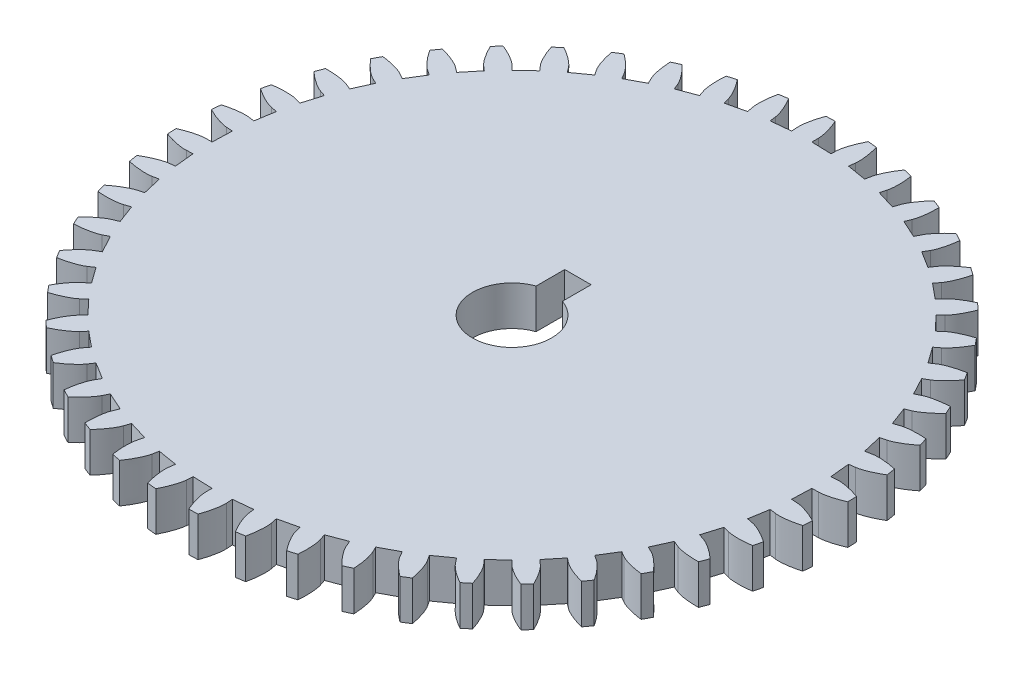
SolidWorks part; units mm, degrees
ref_plane "Front Plane" through (0, 0, 0) normal (0, 0, 1) x (1, 0, 0)
ref_plane "Top Plane" through (0, 0, 0) normal (0, 1, 0) x (1, 0, 0)
ref_plane "Right Plane" through (0, 0, 0) normal (1, 0, 0) x (0, 0, -1)
sketch "Sketch1" plane through (0, 0, 0) normal (0, 1, 0) x (1, 0, 0)
  line L0 (0, 0) -> (0, 11.6178) construction
  line L1 (0, 0) -> (-11.6178, 0) construction
  line L2 (0, 0) -> (-12.4933, -0.409) construction
  line L3 (0, 0) -> (-11.5929, -0.7598) construction
  line L4 (0, 0) -> (-11.5184, -1.5164) construction
  circle A0 centre (0, 0) radius 12 construction
  circle A1 centre (0, 0) radius 11.6178 construction
  circle A2 centre (0, 0) radius 11.375 construction
  circle A3 centre (0, 0) radius 12.5 construction
  spline S0 degree 4 poles (-11.6178, 0) (-11.6346, 0) (-11.6816, -0.0017) (-11.7702, -0.0118) (-11.9134, -0.0378) (-12.0931, -0.085) (-12.321, -0.1616) (-12.5829, -0.2718) (-12.8622, -0.4131) (-13.1555, -0.588) (-13.4378, -0.7806) (-13.7088, -0.9888) (-13.9686, -1.2108) (-14.2704, -1.4951) (-14.6138, -1.8588) (-14.9858, -2.3114) (-15.3716, -2.8607) (-15.7231, -3.4472) (-16.0342, -4.0558) (-16.3059, -4.6833) (-16.51, -5.2451) (-16.6614, -5.7353) (-16.7945, -6.2292) (-16.8903, -6.6473) (-16.9712, -7.0632) (-17.0378, -7.4902) (-17.082, -7.82) (-17.1186, -8.1759) (-17.1454, -8.4873) (-17.1701, -8.9474) (-17.1773, -9.2236) (-17.1811, -9.6653) (-17.1727, -9.8781) (-17.1693, -10.0615) (-17.1657, -10.1111) (-17.1643, -10.1517) knots 0 0 0 0 0 0.005377 0.015084 0.028532 0.04661 0.064855 0.092111 0.119476 0.146842 0.174209 0.201575 0.228941 0.256307 0.307035 0.361767 0.4165 0.471232 0.525964 0.580697 0.635429 0.662795 0.690161 0.744894 0.77226 0.799626 0.826992 0.854358 0.881725 0.909091 0.954545 0.977273 0.988636 1 1 1 1 1 construction
  spline S1 degree 4 poles (-11.6178, 0) (-11.6346, 0) (-11.6816, -0.0017) (-11.7702, -0.0118) (-11.9134, -0.0378) (-12.0931, -0.085) (-12.321, -0.1616) (-12.5829, -0.2718) (-12.8622, -0.4131) (-13.1555, -0.588) (-13.4378, -0.7806) (-13.7088, -0.9888) (-13.9686, -1.2108) (-14.2704, -1.4951) (-14.6138, -1.8588) (-14.9858, -2.3114) (-15.3716, -2.8607) (-15.7231, -3.4472) (-16.0342, -4.0558) (-16.3059, -4.6833) (-16.51, -5.2451) (-16.6614, -5.7353) (-16.7945, -6.2292) (-16.8903, -6.6473) (-16.9712, -7.0632) (-17.0378, -7.4902) (-17.082, -7.82) (-17.1186, -8.1759) (-17.1454, -8.4873) (-17.1613, -8.7835) (-17.1679, -8.9402) (-17.1705, -9.0178) knots 0 0 0 0 0 0.005377 0.015084 0.028532 0.04661 0.064855 0.092111 0.119476 0.146842 0.174209 0.201575 0.228941 0.256307 0.307035 0.361767 0.4165 0.471232 0.525964 0.580697 0.635429 0.662795 0.690161 0.744894 0.77226 0.799626 0.826992 0.854358 0.881725 0.909091 0.909091 0.909091 0.909091 0.909091
  dimension "D1" = 25
  dimension "D2" = 24
  dimension "D3" = 23.2355
  dimension "D4" = 22.75
  dimension "D5" = 11.6178
  dimension "D6" = 1.875
  dimension "D7" = 3.75
  dimension "D8" = 7.5
sketch "Sketch2" plane through (0, 0, 0) normal (0, 1, 0) x (1, 0, 0)
  line L0 (0, 0) -> (-12.4933, -0.409) construction
  line L1 (0, 0) -> (-12.4933, -0.409) construction
  line L2 (0, 0) -> (-11.5929, -0.7598) construction
  line L3 (0, 0) -> (-11.6178, 0) construction
  line L4 (0, 0) -> (-11.5184, -1.5164) construction
  line L5 (0, 0) -> (-11.5929, -0.7598) construction
  line L6 (0, 0) -> (-11.6178, 0) construction
  line L7 (0, 0) -> (-11.5184, -1.5164) construction
  line L8 (-11.5929, -0.7598) -> (-11.3506, -0.744)
  line L9 (-11.3506, -0.744) -> (-11.2777, -1.4847)
  line L10 (-11.2777, -1.4847) -> (-11.5184, -1.5164) construction
  line L11 (-11.2777, -1.4847) -> (-1.4872, -0.1958)
  line L12 (-11.6178, 0) -> (-1.5, 0)
  circle A0 centre (0, 0) radius 11.375 construction
  circle A1 centre (0, 0) radius 11.6178 construction
  circle A2 centre (0, 0) radius 12 construction
  circle A3 centre (0, 0) radius 12.5 construction
  circle A4 centre (0, 0) radius 11.375 construction
  circle A5 centre (0, 0) radius 11.6178 construction
  circle A6 centre (0, 0) radius 12 construction
  circle A7 centre (0, 0) radius 12.5 construction
  arc A8 (-12.4866, -0.5796) -> (-12.4977, -0.2383) centre (0, 0) cw
  circle A11 centre (0, 0) radius 1.5 construction
  arc A12 (-1.5, 0) -> (-1.4872, -0.1958) centre (0, 0) ccw
  spline S0 degree 4 poles (-40.5218, -999.5755) (-8.989, -23.0744) (-9.5874, -0.5071) (-10.7927, 0.166) (-11.9134, -0.0378) (-12.0931, -0.085) (-12.321, -0.1616) (-12.5829, -0.2718) (-12.8622, -0.4131) (-13.1555, -0.588) (-13.4378, -0.7806) (-13.7088, -0.9888) (-13.9686, -1.2108) (-14.2704, -1.4951) (-14.6138, -1.8588) (-14.9858, -2.3114) (-15.3716, -2.8607) (-15.7231, -3.4472) (-16.0342, -4.0558) (-16.3059, -4.6833) (-16.51, -5.2451) (-16.6614, -5.7353) (-16.7945, -6.2292) (-16.8903, -6.6473) (-16.9712, -7.0632) (-17.0378, -7.4902) (-17.082, -7.82) (-17.1186, -8.1759) (-17.2447, -9.644) (-17.2182, -13.2502) (-15.7248, 22.3468) (-49.5832, -1008.4145) knots -0.318217 -0.318217 -0.318217 -0.318217 -0.318217 0.005377 0.015084 0.028532 0.04661 0.064855 0.092111 0.119476 0.146842 0.174209 0.201575 0.228941 0.256307 0.307035 0.361767 0.4165 0.471232 0.525964 0.580697 0.635429 0.662795 0.690161 0.744894 0.77226 0.799626 0.826992 0.854358 0.881725 1.315655 1.315655 1.315655 1.315655 1.315655 only from (-11.6178, 0) to (-17.1705, -9.0178) construction
  spline S1 degree 4 poles (-11.6178, 0) (-11.6346, 0) (-11.6816, -0.0017) (-11.7702, -0.0118) (-11.9134, -0.0378) (-12.0931, -0.085) (-12.2658, -0.1431) (-12.3962, -0.1946) (-12.4732, -0.2276) (-12.4977, -0.2383) knots 0 0 0 0 0 0.005377 0.015084 0.028532 0.04661 0.064855 0.073447 0.073447 0.073447 0.073447 0.073447
  spline S2 degree 4 poles (-11.5929, -0.7598) (-11.6096, -0.7609) (-11.6567, -0.7623) (-11.7458, -0.758) (-11.8903, -0.7414) (-12.0728, -0.7061) (-12.2489, -0.6595) (-12.3824, -0.6166) (-12.4614, -0.5887) (-12.4866, -0.5796) knots 0 0 0 0 0 0.005377 0.015084 0.028532 0.04661 0.064855 0.073447 0.073447 0.073447 0.073447 0.073447
  point P21 (-11.3506, -0.744)
  point P24 (-11.2777, -1.4847)
  dimension "D2" = 3
extrude "Boss-Extrude1" add sketch "Sketch2" along normal blind 1.5
pattern_circular "CirPattern1" count 48 over 360 of "Boss-Extrude1"
sketch "Sketch3" plane through (0, 1.5, 0) normal (0, 1, 0) x (1, 0, 0)
  line L1 (0.5, 0.5) -> (-0.5, 0.5)
  line L2 (0.5, 0.5) -> (0.5, 2.5)
  line L3 (0.5, 2.5) -> (-0.5, 2.5)
  line L4 (-0.5, 0.5) -> (-0.5, 2.5)
  line L5 (0.5, 0.5) -> (-0.5, 2.5) construction
  line L6 (0.5, 2.5) -> (-0.5, 0.5) construction
  circle A0 centre (0, 0) radius 1.5 construction
  point P0 (0, 1.5)
  dimension "D1" = 2
  dimension "D2" = 1
extrude "Cut-Extrude1" cut sketch "Sketch3" against normal up to surface (1.5 mm away)
equation "\"Module\"= .5"
equation "\"Number of Teeth\" = 48"
equation "\"Pressure Angle\"= 14.5deg"
equation "\"Pitch Diameter\"= \"Number of Teeth\" * \"Module\""
equation "\"Circular Pitch\"= pi * \"Module\""
equation "\"Addendum\"= \"Module\""
equation "\"Dedendum\"= 1.25 * \"Module\""
equation "\"Base Diameter\"= \"Pitch Diameter\" * cos ( \"Pressure Angle\" )"
equation "\"Base Radius\"= \"Base Diameter\" / 2"
equation "\"Width\"= 1.5"
equation "\"Outside Diameter\"= \"Pitch Diameter\" + 2 * \"Addendum\""
equation "\"D1@Sketch1\"=\"Outside Diameter\""
equation "\"D3@Sketch1\"=\"Base Diameter\""
equation "\"Root Diameter\"= \"Pitch Diameter\" - 2 * \"Dedendum\""
equation "\"D4@Sketch1\"=\"Root Diameter\""
equation "\"Tooth Angle\"= 360 / \"Number of Teeth\""
equation "\"D6@Sketch1\"=\"Tooth Angle\"/4"
equation "\"D7@Sketch1\"=\"Tooth Angle\"/2"
equation "\"D8@Sketch1\"=\"Tooth Angle\""
equation "\"D2@Sketch1\" = \"Pitch Diameter\""
equation "\"Shaft Diameter\"= 3"
equation "\"D1@CirPattern1\" = \"Number of Teeth\""
equation "\"D2@Sketch2\"= \"Shaft Diameter\""
equation "\"D1@Boss-Extrude1\" = \"Width\""
